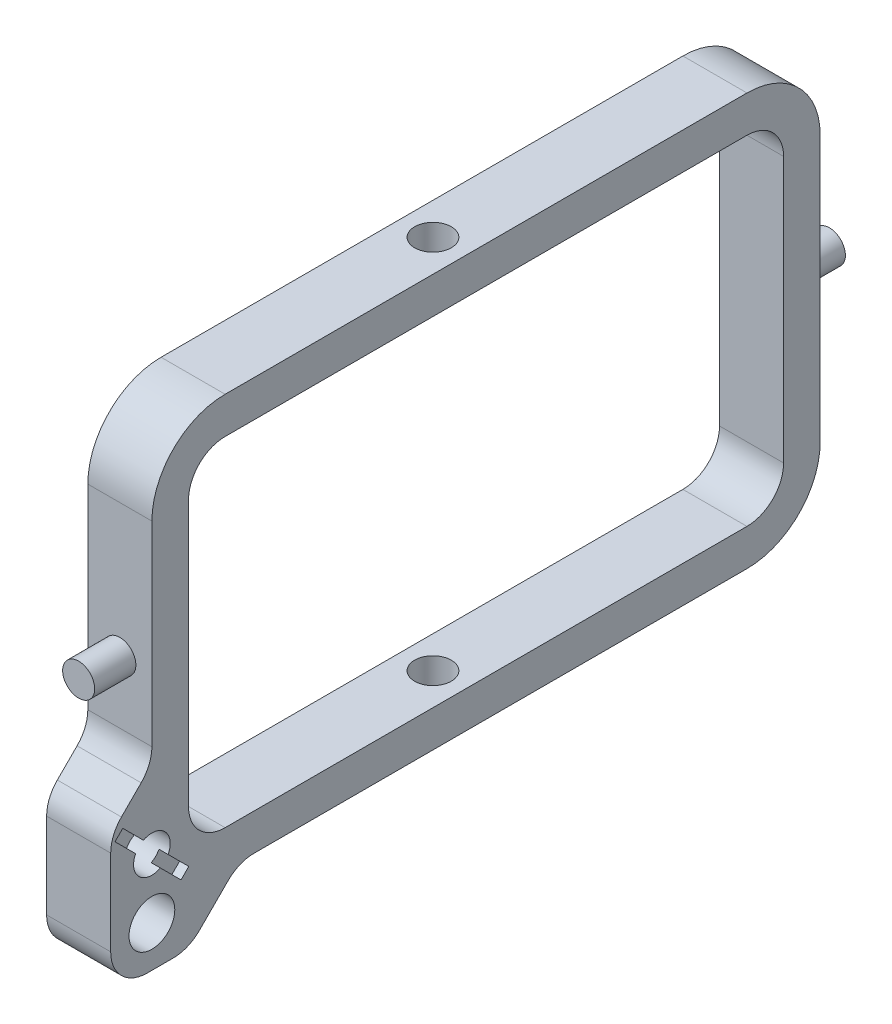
SolidWorks part; units mm, degrees
ref_plane "Front Plane" through (0, 0, 0) normal (1, 0, 0) x (0, 1, 0)
ref_plane "Top Plane" through (0, 0, 0) normal (0, 0, 1) x (0, 1, 0)
ref_plane "Right Plane" through (0, 0, 0) normal (0, 1, 0) x (-1, 0, 0)
sketch "Sketch1" plane through (0, 0, 0) normal (1, 0, 0) x (0, 1, 0)
  line L0 (-22.5, 0) -> (22.5, 0)
  line L1 (22.5, 0) -> (22.5, 73)
  line L2 (22.5, 73) -> (-8.5, 73)
  line L4 (-18.5, 4) -> (18.5, 4)
  line L5 (18.5, 4) -> (18.5, 69)
  line L6 (18.5, 69) -> (-18.5, 69)
  line L7 (-18.5, 69) -> (-18.5, 4)
  line L8 (0, 69) -> (0, 56) construction
  line L9 (-8.5, 73) -> (-13, 77.5)
  line L10 (-13, 77.5) -> (-28, 77.5)
  line L12 (-28, 69) -> (-22.5, 63.5)
  line L13 (-23.5, 73) -> (-23.5, 77.5) construction
  line L14 (-23.5, 73) -> (-28, 73) construction
  line L15 (-28, 77.5) -> (-28, 69)
  line L16 (-22.5, 63.5) -> (-22.5, 0)
  line L17 (-15, 73) -> (-15, 77.5) construction
  circle A0 centre (-23.5, 73) radius 2.5
  circle A1 centre (-17, 73) radius 2
  point P4 (0, 0)
  point P10 (0, 4)
  dimension "D6" = 5
  dimension "D7" = 4
  dimension "D1" = 37
  dimension "D2" = 135
  dimension "D3" = 4
  dimension "D4" = 65
  dimension "D5" = 4
  dimension "D8" = 17
  dimension "D9" = 23.5
  dimension "D10" = 4.5
  dimension "D11" = 4
  dimension "D12" = 4
  dimension "D13" = 2
extrude "Boss-Extrude1" add sketch "Sketch1" along normal blind 7
sketch "Sketch6" plane through (0, -22.5, 0) normal (0, -1, 0) x (1, 0, 0)
  line L0 (7, 63.5) -> (0, 63.5) construction
  circle A0 centre (3.5, 38.8) radius 2
  point P4 (3.5, 63.5)
  dimension "D2" = 4
  dimension "D1" = 30.2
extrude "Cut-Extrude2" cut sketch "Sketch6" against normal through all
sketch "Sketch5" plane through (0, 0, 0) normal (0, 0, -1) x (1, 0, 0)
  line L1 (7, 22.5) -> (0, 22.5) construction
  circle A0 centre (3.5, 0) radius 1.75
  point P5 (3.5, 22.5)
  dimension "D1" = 3.5
extrude "Boss-Extrude3" add sketch "Sketch5" along normal blind 4.5
ref_plane "Plane1" through (0, 0, 36.5) normal (0, 0, -1) x (-1, 0, 0)
mirror "Mirror2" about plane through (0, 0, 36.5) normal (0, 0, -1) of "Boss-Extrude3"
sketch "Sketch8" plane through (7, 0, 0) normal (1, 0, 0) x (0, 1, 0)
  line L0 (-20.6062, 69.3938) -> (-13.3938, 76.6062) construction
  line L1 (18.5, 69) -> (-18.5, 69) construction
  line L2 (-13.818, 77.0305) -> (-12.9695, 76.182)
  line L3 (-12.9695, 76.182) -> (-20.182, 68.9695)
  line L4 (-20.182, 68.9695) -> (-21.0305, 69.818)
  line L5 (-21.0305, 69.818) -> (-13.818, 77.0305)
  circle A0 centre (-17, 73) radius 2 construction
  point P4 (-17, 73)
  point P10 (-13.3938, 76.6062)
  dimension "D1" = 10.2
  dimension "D2" = 45
  dimension "D3" = 1.2
extrude "Cut-Extrude3" cut sketch "Sketch8" against normal blind 1
fillet "Fillet1" radius 4 5 edges at (3.5, -28, 69) (3.5, -22.5, 63.5) (3.5, -28, 77.5) (3.5, -13, 77.5) (3.5, -8.5, 73)
fillet "Fillet2" radius 8 3 edges at (3.5, -22.5, 0) (3.5, 22.5, 0) (3.5, 22.5, 73)
fillet "Fillet3" radius 4 4 edges at (3.5, -18.5, 69) (3.5, -18.5, 4) (3.5, 18.5, 4) (3.5, 18.5, 69)
